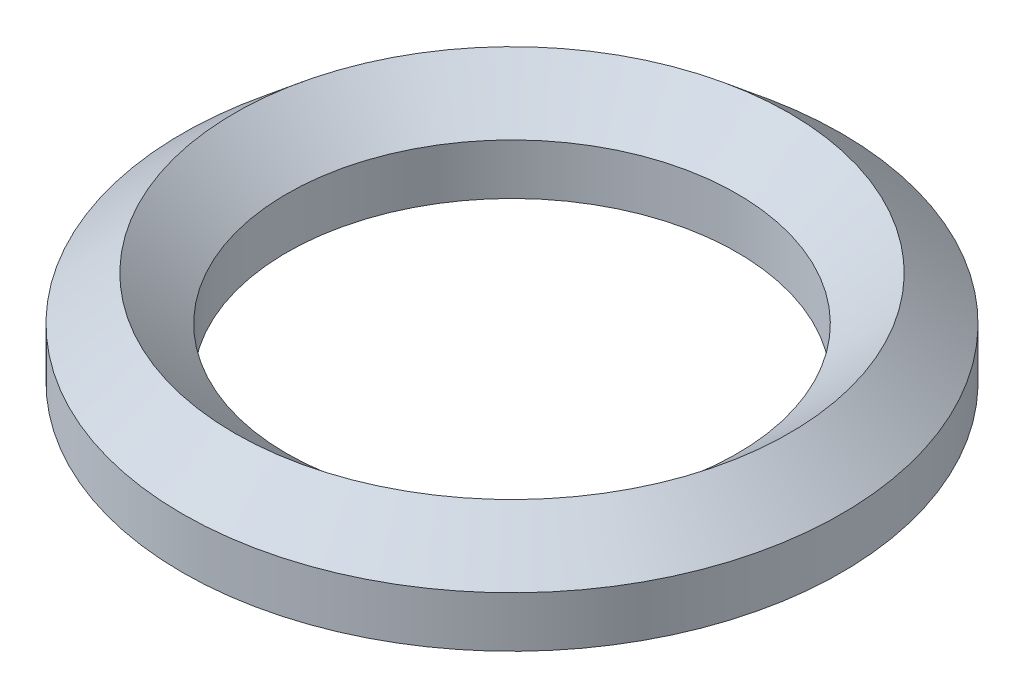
SolidWorks part; units mm, degrees
ref_plane "前基準面" through (0, 0, 0) normal (0, 0, 1) x (1, 0, 0)
ref_plane "上基準面" through (0, 0, 0) normal (0, 1, 0) x (1, 0, 0)
ref_plane "右基準面" through (0, 0, 0) normal (1, 0, 0) x (0, 0, -1)
sketch "草圖2" plane through (0, 0, 0) normal (1, 0, 0) x (0, 0, -1)
  line L0 (0, 2.5656) -> (0, -2.5656) construction
  line L2 (11.1, -4.6607) -> (16.25, -4.6607)
  line L3 (11.1, -2.1607) -> (11.1, -4.6607)
  line L4 (13.675, 0) -> (11.1, -2.1607)
  line L5 (16.25, -2.1607) -> (16.25, -4.6607)
  line L7 (13.675, 0) -> (16.25, -2.1607)
  dimension "D1" = 22.2
  dimension "D2" = 32.5
  dimension "D3" = 2.5
  dimension "D5" = 100
  dimension "D6" = 50
revolve "旋轉1" add sketch "草圖2" angle 360 about L0
